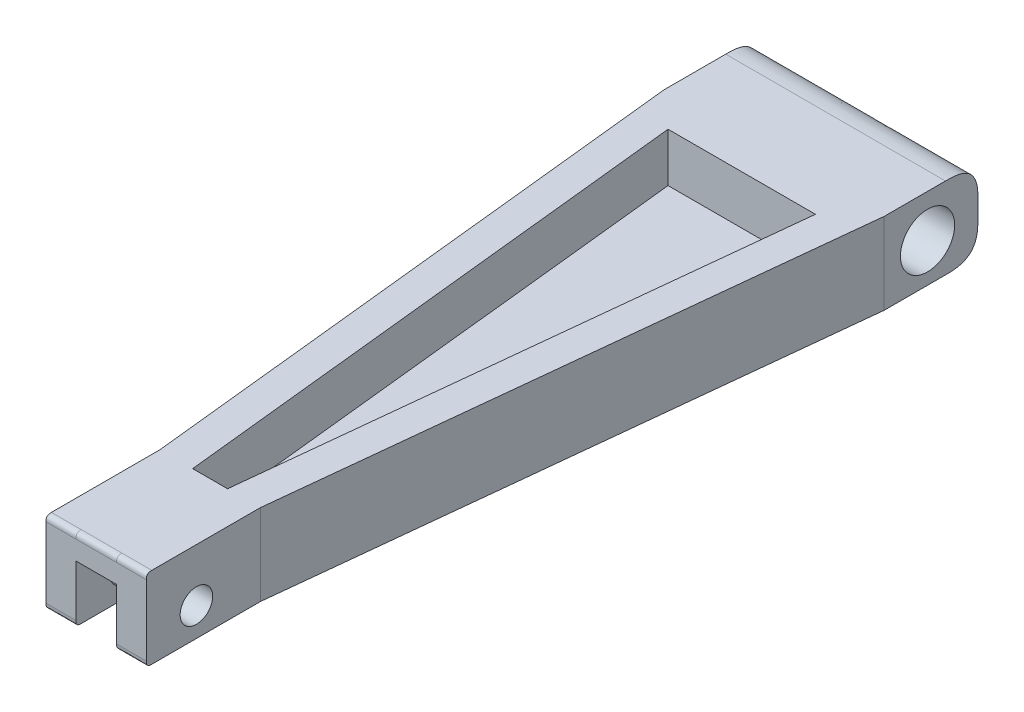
SolidWorks part; units mm, degrees
ref_plane "Front Plane" through (0, 0, 0) normal (0, 0, 1) x (1, 0, 0)
ref_plane "Top Plane" through (0, 0, 0) normal (0, 1, 0) x (1, 0, 0)
ref_plane "Right Plane" through (0, 0, 0) normal (1, 0, 0) x (0, 0, -1)
sketch "Sketch1" plane through (0, 0, 0) normal (0, 1, 0) x (1, 0, 0)
  line L0 (0, 0) -> (55, 0)
  line L1 (185, 0) -> (185, 210)
  line L2 (0, 0) -> (0, 210)
  line L3 (0, 210) -> (-110, 1250)
  line L4 (185, 210) -> (295, 1250)
  line L5 (295, 1250) -> (-110, 1250)
  line L6 (55, 0) -> (55, 200)
  line L7 (55, 200) -> (130, 200)
  line L8 (130, 200) -> (130, 0)
  line L9 (130, 0) -> (185, 0)
  point P3 (150, 209.5429)
  dimension "D1" = 185
  dimension "D2" = 1250
  dimension "D3" = 75
  dimension "D4" = 405
  dimension "D5" = 200
  dimension "D6" = 210
extrude "Boss-Extrude1" add sketch "Sketch1" along normal blind 150
sketch "Sketch2" plane through (185, 0, 0) normal (1, 0, 0) x (0, 0, -1)
  circle A0 centre (92.2859, 52.657) radius 30
  point P2 (92.2859, 52.657)
  point P3 (0, 0)
  dimension "D1" = 60
extrude "Cut-Extrude1" cut sketch "Sketch2" against normal through all
fillet "Fillet1" radius 10 4 edges at (157.5, 150, 0) (157.5, 0, 0) (27.5, 0, 0) (27.5, 150, 0)
sketch "Sketch4" plane through (0, 0, -200) normal (0, 0, 1) x (1, 0, 0)
  line L0 (130, 150) -> (130, 0) construction
  line L1 (55, 150) -> (130, 150)
  line L2 (55, 150) -> (55, 105)
  line L3 (55, 105) -> (130, 105)
  line L4 (130, 150) -> (130, 105)
  dimension "D1" = 45
extrude "Boss-Extrude2" add sketch "Sketch4" along normal blind 200
fillet "Fillet2" radius 10 1 edges at (92.5, 150, 0)
shell "Shell1" thickness 60
sketch "Sketch5" plane through (0, 0, -1250) normal (0, 0, -1) x (-1, 0, 0)
  line L1 (-295, 150) -> (110, 150)
  line L2 (-295, 150) -> (-295, 0)
  line L3 (-295, 0) -> (110, 0)
  line L4 (110, 150) -> (110, 0)
extrude "Boss-Extrude3" add sketch "Sketch5" along normal blind 173
sketch "Sketch6" plane through (-110, 0, 0) normal (-1, 0, 0) x (0, 0, 1)
  circle A0 centre (-1329.9901, 71.4075) radius 50
  point P2 (-1329.9901, 71.4075)
  dimension "D1" = 100
extrude "Cut-Extrude2" cut sketch "Sketch6" against normal through all
fillet "Fillet5" radius 60 2 edges at (92.5, 0, -1423) (92.5, 150, -1423)
fillet "Fillet6" radius 70 1 edges at (92.5, 0, -200)
